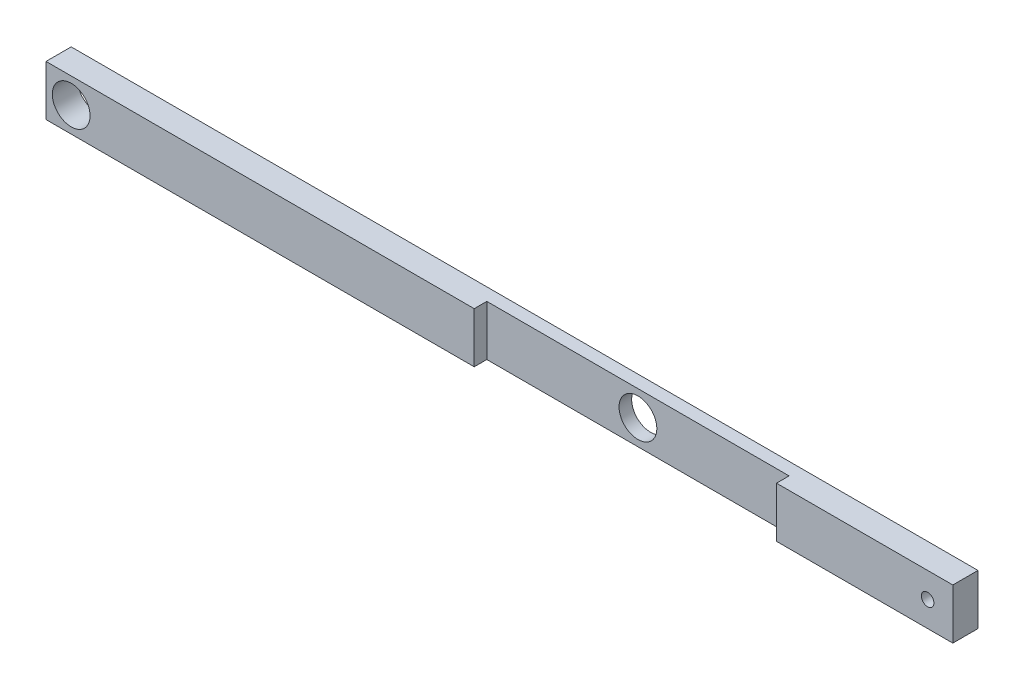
SolidWorks part; units mm, degrees
ref_plane "正面" through (0, 0, 0) normal (0, 0, 1) x (1, 0, 0)
ref_plane "平面" through (0, 0, 0) normal (0, 1, 0) x (1, 0, 0)
ref_plane "右側面" through (0, 0, 0) normal (1, 0, 0) x (0, 0, -1)
sketch "ｽｹｯﾁ1" plane through (0, 0, 0) normal (0, 0, 1) x (1, 0, 0)
  line L1 (0, 0) -> (360, 0)
  line L2 (0, 0) -> (0, 20)
  line L3 (0, 20) -> (360, 20)
  line L4 (360, 0) -> (360, 20)
  dimension "D1" = 20
  dimension "D2" = 360
extrude "押し出し1" add sketch "ｽｹｯﾁ1" along normal blind 10
sketch "ｽｹｯﾁ2" plane through (0, 0, 10) normal (0, 0, 1) x (1, 0, 0)
  line L0 (0, 0) -> (360, 0) construction
  line L4 (0, 20) -> (0, 0) construction
  circle A0 centre (10, 10) radius 7.5
  dimension "D3" = 15
  dimension "D1" = 10
  dimension "D2" = 10
extrude "押し出し2" cut sketch "ｽｹｯﾁ2" against normal through all
sketch "ｽｹｯﾁ3" plane through (0, 0, 10) normal (0, 0, 1) x (1, 0, 0)
  line L0 (0, 0) -> (360, 0) construction
  circle A0 centre (230, 10) radius 7.5
  circle A1 centre (10, 10) radius 7.5 construction
  dimension "D3" = 15
  dimension "D1" = 10
  dimension "D2" = 220
extrude "押し出し3" cut sketch "ｽｹｯﾁ3" against normal through all
sketch "ｽｹｯﾁ4" plane through (0, 0, 10) normal (0, 0, 1) x (1, 0, 0)
  line L0 (0, 0) -> (360, 0) construction
  circle A0 centre (350, 10) radius 2.5
  circle A1 centre (230, 10) radius 7.5 construction
  dimension "D1" = 5
  dimension "D2" = 120
  dimension "D3" = 10
extrude "押し出し4" cut sketch "ｽｹｯﾁ4" against normal through all
sketch "ｽｹｯﾁ5" plane through (0, 0, 10) normal (0, 0, 1) x (1, 0, 0)
  line L0 (0, 0) -> (360, 0) construction
  line L1 (170, 0) -> (290, 0)
  line L2 (170, 0) -> (170, 20)
  line L3 (170, 20) -> (290, 20)
  line L4 (290, 0) -> (290, 20)
  line L5 (360, 20) -> (0, 20) construction
  circle A0 centre (230, 10) radius 7.5 construction
  dimension "D1" = 120
  dimension "D2" = 60
extrude "押し出し5" cut sketch "ｽｹｯﾁ5" against normal blind 5
